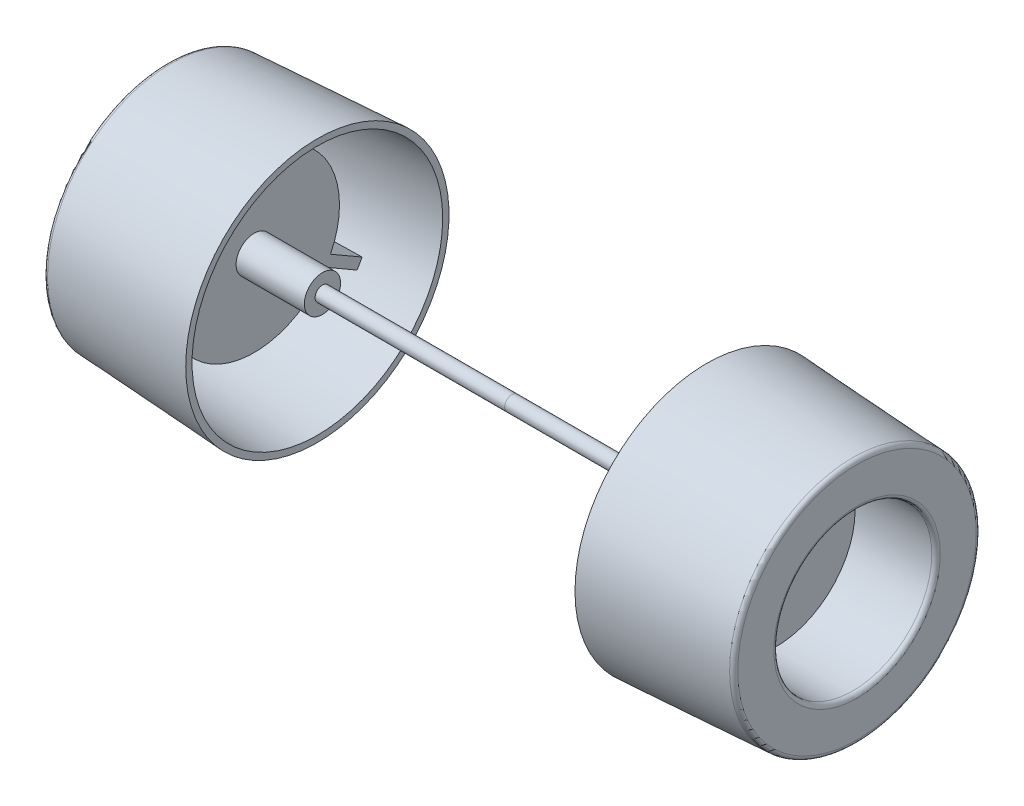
SolidWorks part; units mm, degrees
ref_plane "Alzado" through (0, 0, 0) normal (0, 0, 1) x (1, 0, 0)
ref_plane "Planta" through (0, 0, 0) normal (0, 1, 0) x (1, 0, 0)
ref_plane "Vista lateral" through (0, 0, 0) normal (1, 0, 0) x (0, 0, -1)
sketch "Croquis1" plane through (0, 0, 0) normal (1, 0, 0) x (0, 0, -1)
  circle A0 centre (0, 0) radius 29.25
ref_plane "Plano1" through (-35.7, 0, 0) normal (1, 0, 0) x (0, 0, -1)
sketch "Croquis2" plane through (-35.7, 0, 0) normal (1, 0, 0) x (0, 0, -1)
  circle A0 centre (0, 0) radius 31.25
loft "Recubrir1" add profiles "Croquis2", "Croquis1"
sketch "Croquis3" plane through (0, 0, 0) normal (1, 0, 0) x (0, 0, -1)
  circle A0 centre (0, 0) radius 18.75
extrude "Cortar-Extruir1" cut sketch "Croquis3" against normal blind 19.2
shell "Vaciado1" thickness 1.5
sketch "Croquis4" plane through (-20.7, 0, 0) normal (-1, 0, 0) x (0, 0, 1)
  line L0 (1.2023, 20.2143) -> (1.2023, 29.7233)
  line L1 (0, 0) -> (0, -6.9672) construction
  line L2 (-1.2023, 20.2143) -> (-1.2023, 29.7233)
  line L3 (16.9049, -11.1484) -> (25.14, -15.9029)
  line L4 (18.1072, -9.0659) -> (26.3423, -13.8204)
  line L5 (-18.1072, -9.0659) -> (-26.3423, -13.8204)
  line L6 (-16.9049, -11.1484) -> (-25.14, -15.9029)
  circle A0 centre (0, 0) radius 20.25 construction
  circle A1 centre (0, 0) radius 29.7476 construction
  arc A2 (1.2023, 20.2143) -> (-1.2023, 20.2143) centre (0, 0) ccw
  arc A3 (1.2023, 29.7233) -> (-1.2023, 29.7233) centre (0, 0) ccw
  arc A4 (16.9049, -11.1484) -> (18.1072, -9.0659) centre (0, 0) ccw
  arc A5 (25.14, -15.9029) -> (26.3423, -13.8204) centre (0, 0) ccw
  arc A6 (-18.1072, -9.0659) -> (-16.9049, -11.1484) centre (0, 0) ccw
  arc A7 (-26.3423, -13.8204) -> (-25.14, -15.9029) centre (0, 0) ccw
extrude "Extruir1" add sketch "Croquis4" against normal blind 8
sketch "Croquis5" plane through (-20.7, 0, 0) normal (-1, 0, 0) x (0, 0, 1)
  circle A0 centre (0, 0) radius 4.3
  circle A1 centre (0, 0) radius 1.745
extrude "Extruir2" add sketch "Croquis5" along normal blind 16.2
fillet "Redondeo1" radius 1 2 edges at (0, 0, -29.25) (0, 0, -18.75)
sketch "Croquis6" plane through (-36.9, 0, 0) normal (-1, 0, 0) x (0, 0, 1)
  circle A0 centre (0, 0) radius 1.745
extrude "Extruir3" add sketch "Croquis6" along normal blind 45
mirror "Simetría1" about plane through (-81.9, 0, 0) normal (-1, 0, 0)
